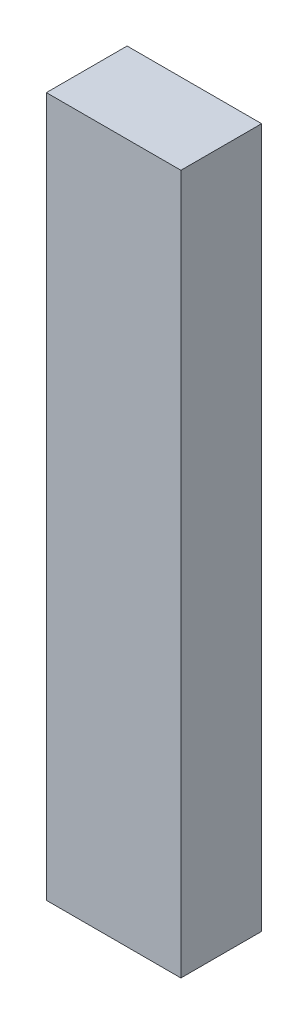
SolidWorks part; units mm, degrees
ref_plane "Front Plane" through (0, 0, 0) normal (1, 0, 0) x (0, 1, 0)
ref_plane "Top Plane" through (0, 0, 0) normal (0, 0, 1) x (0, 1, 0)
ref_plane "Right Plane" through (0, 0, 0) normal (0, 1, 0) x (-1, 0, 0)
sketch "Sketch1" plane through (0, 0, 0) normal (1, 0, 0) x (0, 1, 0)
  line L0 (-165.1, 0) -> (165.1, 0)
  line L1 (165.1, 0) -> (165.1, 38.1)
  line L2 (165.1, 38.1) -> (-165.1, 38.1)
  line L3 (-165.1, 38.1) -> (-165.1, 0)
extrude "Panel_or_block" add sketch "Sketch1" along normal blind 63.5
